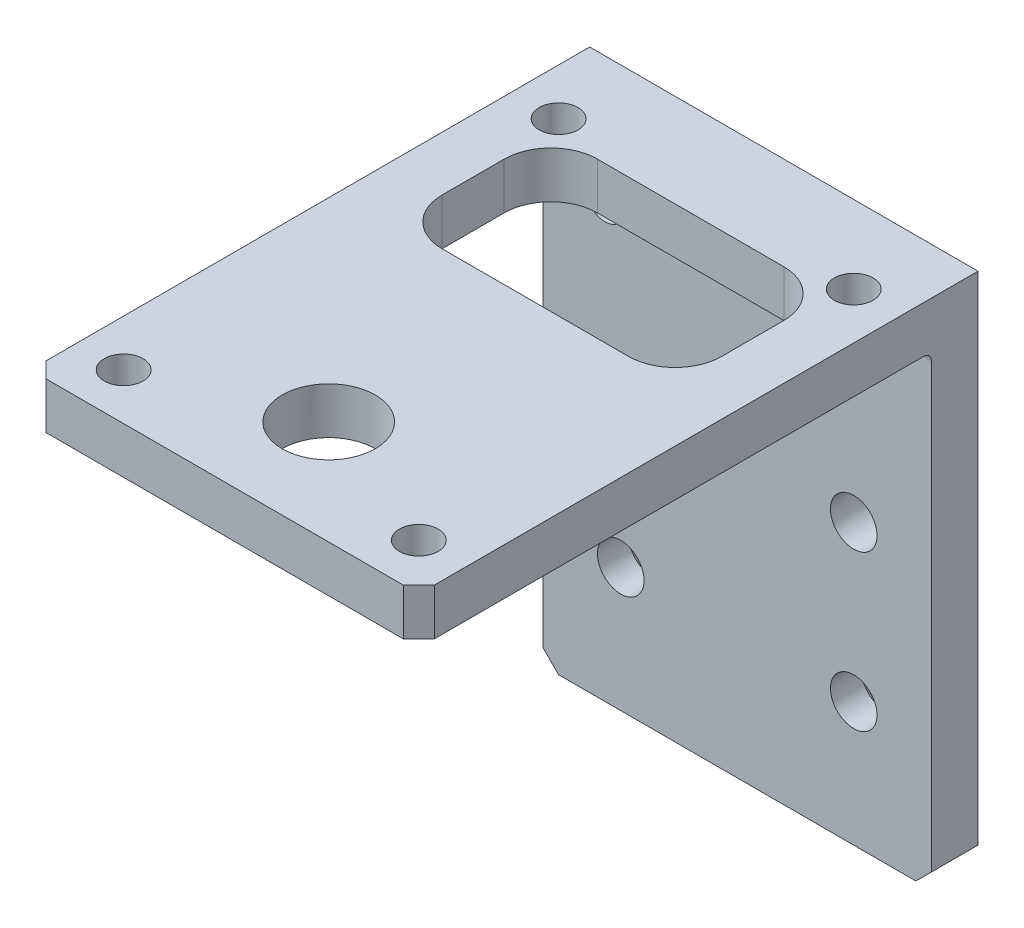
SolidWorks part; units mm, degrees
ref_plane "前视基准面" through (0, 0, 0) normal (0, 0, 1) x (1, 0, 0)
ref_plane "上视基准面" through (0, 0, 0) normal (0, 1, 0) x (1, 0, 0)
ref_plane "右视基准面" through (0, 0, 0) normal (1, 0, 0) x (0, 0, -1)
ref_plane "基准面4" through (-12.6575, 0, 0) normal (-1, 0, 0) x (0, -1, 0)
sketch "草图1" plane through (-12.6575, 0, 0) normal (-1, 0, 0) x (0, -1, 0)
  line L0 (-3, -12.5) -> (30, -12.5)
  line L1 (30, -12.5) -> (30, 23.5)
  line L2 (30, 23.5) -> (-3, 23.5)
  line L3 (-3, 23.5) -> (-3, -12.5)
extrude "凸台-拉伸1" add sketch "草图1" against normal blind 25
sketch "草图2" plane through (12.3425, 0, 0) normal (1, 0, 0) x (0, 0, -1)
  line L0 (9.5, -30) -> (9.5, 0)
  line L1 (9.5, 0) -> (-23.5, 0)
  line L2 (-23.5, 0) -> (-23.5, -30)
  line L3 (-23.5, -30) -> (9.5, -30)
extrude "切除-拉伸1" cut sketch "草图2" against normal through all
sketch "草图3" plane through (0, 3, 0) normal (0, 1, 0) x (-1, 0, 0)
  line L0 (9.1575, -3.5) -> (9.1575, 3.5)
  line L1 (9.1575, 3.5) -> (-8.8425, 3.5)
  line L2 (-8.8425, 3.5) -> (-8.8425, -3.5)
  line L3 (-5.8425, -6.5) -> (6.1575, -6.5)
  arc A0 (-8.8425, -3.5) -> (-5.8425, -6.5) centre (-5.8425, -3.5) ccw
  arc A1 (6.1575, -6.5) -> (9.1575, -3.5) centre (6.1575, -3.5) ccw
extrude "切除-拉伸2" cut sketch "草图3" against normal through all
hole_wizard "Ø3.0 (3) 直径孔1" positions "草图5" profile "草图4" hole size "Ø3.0" standard "GB"
sketch "草图5" plane through (0, 0, -12.5) normal (0, 0, -1) x (-1, 0, 0)
  point P0 (7.6575, -22)
  point P1 (-7.3425, -12)
  point P2 (7.6575, -12)
  point P3 (-7.3425, -22)
sketch "草图4" plane through (-7.6575, -22, -12.5) normal (1, 0, 0) x (0, 1, 0)
  line L0 (0, 0) -> (0, 36)
  line L1 (0, 36) -> (1.5, 36)
  line L2 (1.5, 36) -> (1.5, 0)
  line L5 (1.5, 0) -> (0, 0)
  line L11 (0, -6.35) -> (0, 107.95) construction
  dimension "通孔孔直径" = 3
  dimension "通孔孔深度" = 36
hole_wizard "Ø6.0 (6) 直径孔1" positions "草图7" profile "草图6" hole size "Ø6.0" standard "ANSI Metric"
sketch "草图7" plane through (0, 3, 0) normal (0, 1, 0) x (1, 0, 0)
  point P0 (-0.1575, -16.8)
sketch "草图6" plane through (-0.1575, 3, 16.8) normal (1, 0, 0) x (0, 0, 1)
  line L0 (0, 0) -> (0, 33)
  line L1 (0, 33) -> (3, 33)
  line L2 (3, 33) -> (3, 0)
  line L5 (3, 0) -> (0, 0)
  line L11 (0, -6.35) -> (0, 107.95) construction
  dimension "通孔孔直径" = 6
  dimension "通孔孔深度" = 33
hole_wizard "M3 螺纹孔2" positions "草图9" profile "草图8" tap size "M3" standard "GB"
sketch "草图9" plane through (0, 3, 0) normal (0, 1, 0) x (1, 0, 0)
  point P0 (9.3425, 7.5)
  point P1 (9.3425, -20.5)
  point P2 (-9.6575, -20.5)
  point P3 (-9.6575, 7.5)
sketch "草图8" plane through (9.3425, 3, -7.5) normal (1, 0, 0) x (0, 0, 1)
  line L0 (0, 0) -> (0, 3.7501)
  line L1 (0, 3.7501) -> (1.25, 2.999)
  line L2 (1.25, 2.999) -> (1.25, 0)
  line L5 (1.25, 0) -> (0, 0)
  line L10 (0, 3.7501) -> (-1.25, 2.999) construction
  line L11 (0, -6.35) -> (0, 107.95) construction
  dimension "螺纹孔钻头直径" = 2.5
  dimension "螺纹孔钻头深度" = 2.999
  dimension "导头角度" = 118
chamfer "倒角1" distance 1 angle 45 4 edges at (-12.6575, 1.5, 23.5) (12.3425, -30, -11) (-12.6575, -30, -11) (12.3425, 1.5, 23.5)
fillet "圆角1" radius 0.5 1 edges at (-0.1575, 0, -9.5)
fillet "圆角2" radius 3 2 edges at (8.8425, 1.5, 3.5) (-9.1575, 1.5, 3.5)
sketch "草图11" plane through (0, 0, -12.5) normal (0, 0, -1) x (-1, 0, 0)
  line L0 (-12.3425, 3) -> (-12.3425, -29) construction
  line L1 (12.6575, 3) -> (12.6575, -29) construction
  line L2 (-12.3425, 3) -> (12.6575, 3) construction
  point P0 (-8.3425, -2)
  point P1 (8.6575, -2)
  dimension "D1" = 4
  dimension "D2" = 4
  dimension "D3" = 5
  dimension "D4" = 5
hole_wizard "M3 螺纹孔1" positions "3D草图1" profile "草图13" tap size "M3" standard "GB"
sketch3d "3D草图1"
  point P0 (8.3425, -2, -12.5)
  point P3 (-8.6575, -2, -12.5)
sketch "草图13" plane through (8.3425, -2, -12.5) normal (1, 0, 0) x (0, 1, 0)
  line L0 (0, 0) -> (0, 3)
  line L1 (0, 3) -> (1.25, 3)
  line L2 (1.25, 3) -> (1.25, 0)
  line L5 (1.25, 0) -> (0, 0)
  line L11 (0, -6.35) -> (0, 107.95) construction
  dimension "通孔螺纹孔钻头直径" = 2.5
  dimension "通孔螺纹孔钻头深度" = 3
chamfer "倒角2" distance 1 angle 45 2 edges at (5.8425, -22, -12.5) (-9.1575, -22, -12.5)
